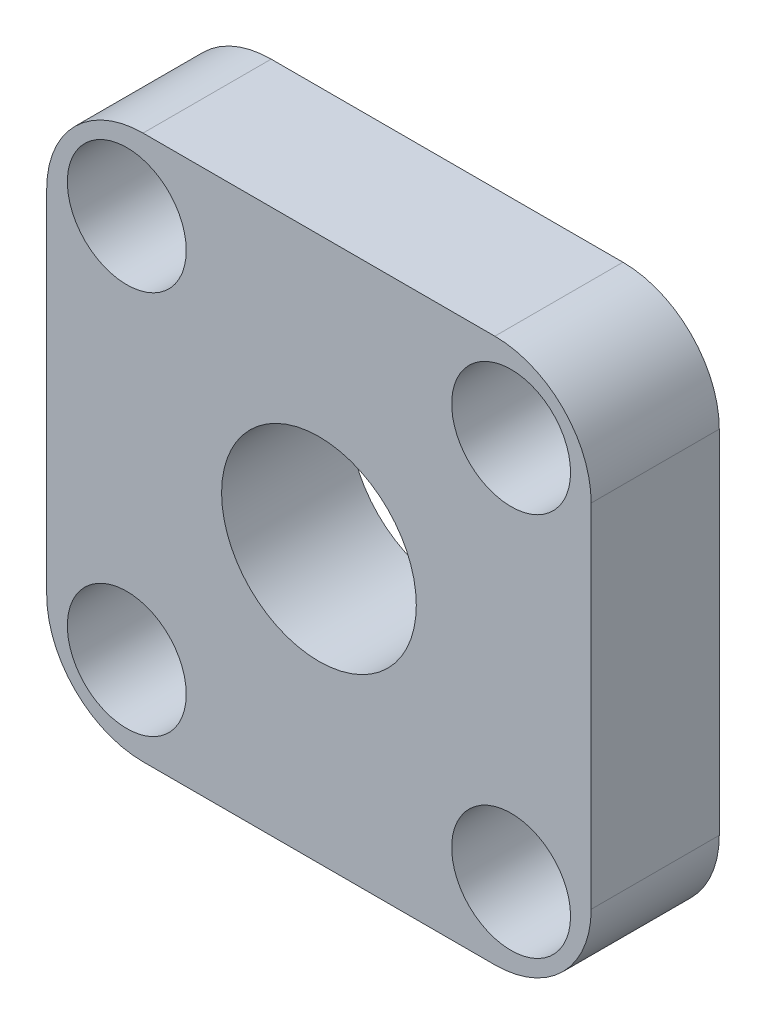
SolidWorks part; units mm, degrees
ref_plane "Front" through (0, 0, 0) normal (0, 0, 1) x (1, 0, 0)
ref_plane "Top" through (0, 0, 0) normal (0, 1, 0) x (1, 0, 0)
ref_plane "Right" through (0, 0, 0) normal (1, 0, 0) x (0, 0, -1)
sketch "Sketch1" plane through (0, 0, 0) normal (0, 0, 1) x (1, 0, 0)
  line L1 (-6.7469, 6.7469) -> (6.7469, 6.7469)
  line L2 (-6.7469, 6.7469) -> (-6.7469, -6.7469)
  line L3 (-6.7469, -6.7469) -> (6.7469, -6.7469)
  line L4 (6.7469, 6.7469) -> (6.7469, -6.7469)
  circle A0 centre (0, 0) radius 6.7469 construction
  circle A1 centre (0, 0) radius 2.413
  dimension "D1" = 13.4937
  dimension "D2" = 4.826
extrude "Boss-Extrude1" add sketch "Sketch1" along normal blind 3.175
hole_wizard "1/8 (0.125) Diameter Hole1" positions "Sketch3" profile "Sketch5" hole size "1/8" standard "Ansi Inch"
sketch "Sketch3" plane through (0, 0, 3.175) normal (0, 0, 1) x (1, 0, 0)
  point P0 (4.7625, 4.7625)
  point P1 (-4.7625, 4.7625)
  point P3 (-4.7625, -4.7625)
  point P5 (4.7625, -4.7625)
  dimension "D1" = 4.7625
  dimension "D2" = 4.7625
  dimension "D3" = 4.7625
  dimension "D4" = 4.7625
sketch "Sketch5" plane through (4.7625, 4.7625, 3.175) normal (1, 0, 0) x (0, -1, 0)
  line L0 (0, 0) -> (0, 3.175)
  line L1 (0, 3.175) -> (1.4732, 3.175)
  line L2 (1.4732, 3.175) -> (1.4732, 0)
  line L5 (1.4732, 0) -> (0, 0)
  line L11 (0, -6.35) -> (0, 107.95) construction
  dimension "Thru Hole Dia." = 2.9464
  dimension "Thru Hole Depth" = 3.175
sketch "Sketch6" plane through (0, 0, 3.175) normal (0, 0, 1) x (1, 0, 0)
  circle A1 centre (0, 66.675) radius 74.2188
sketch "Sketch7" plane through (0, 0, 3.175) normal (0, 0, 1) x (1, 0, 0)
  circle A0 centre (-4.7625, -4.7625) radius 2.3241
  circle A1 centre (-4.7625, -4.7625) radius 1.4732 construction
  dimension "D1" = 4.6482
fillet "Fillet3" radius 2.3876 4 edges at (-6.7469, -6.7469, 1.5875) (-6.7469, 6.7469, 1.5875) (6.7469, 6.7469, 1.5875) (6.7469, -6.7469, 1.5875)
equation "\"D4@Sketch3\" = \"D2@Sketch3\""
equation "\"D1@Sketch3\" = \"D2@Sketch3\""
equation "\"D3@Sketch3\" = \"D2@Sketch3\""
